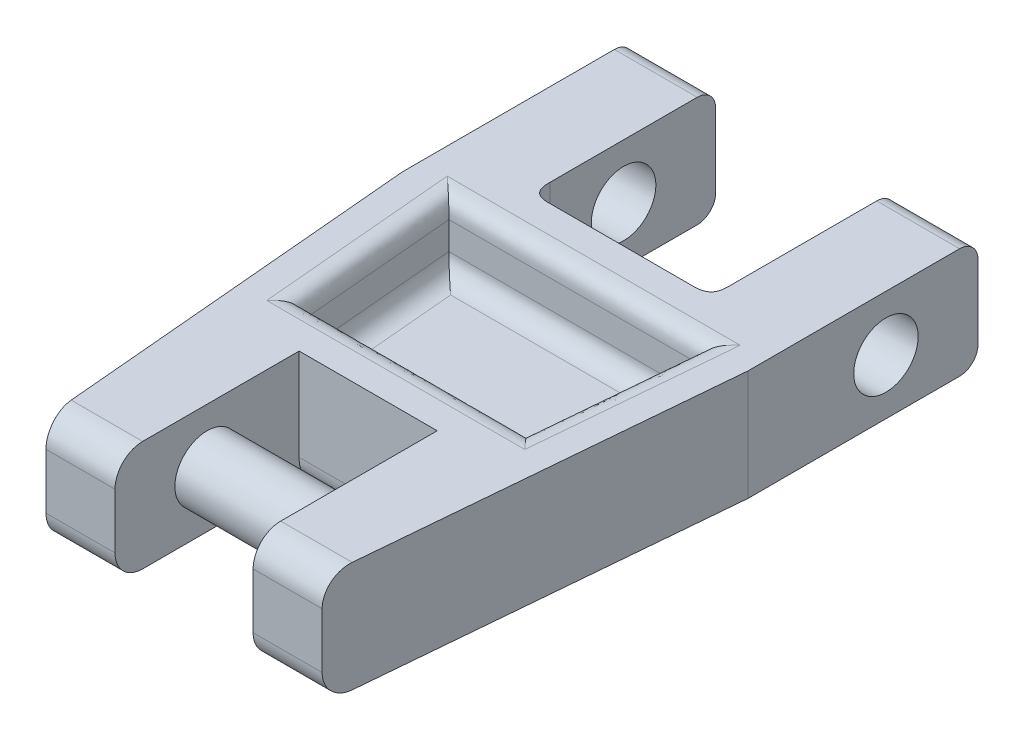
SolidWorks part; units mm, degrees
ref_plane "Front Plane" through (0, 0, 0) normal (0, 0, 1) x (1, 0, 0)
ref_plane "Top Plane" through (0, 0, 0) normal (0, 1, 0) x (1, 0, 0)
ref_plane "Right Plane" through (0, 0, 0) normal (1, 0, 0) x (0, 0, -1)
sketch "Sketch1" plane through (0, 0, 0) normal (0, 1, 0) x (1, 0, 0)
  line L0 (-165.918, 0) -> (-75.918, 0)
  line L1 (-165.918, 0) -> (-165.918, -250)
  line L2 (209.082, 0) -> (209.082, -250)
  line L3 (-165.918, -250) -> (-128.418, -675)
  line L4 (209.082, -250) -> (171.582, -675)
  line L5 (-128.418, -675) -> (-53.418, -675)
  line L6 (-53.418, -675) -> (-53.418, -475)
  line L7 (-53.418, -475) -> (96.582, -475)
  line L8 (96.582, -475) -> (96.582, -675)
  line L9 (96.582, -675) -> (171.582, -675)
  line L10 (-75.918, 0) -> (-75.918, -200)
  line L11 (-75.918, -200) -> (119.082, -200)
  line L12 (119.082, -200) -> (119.082, 0)
  line L13 (119.082, 0) -> (209.082, 0)
  point P4 (0, 0)
  point P14 (-116.3314, -151.9531)
  point P17 (114.082, -205.0143)
  point P18 (-75.918, -100)
  point P19 (-53.418, -575)
  point P20 (0, 0)
  dimension "D1" = 375
  dimension "D2" = 195
  dimension "D3" = 250
  dimension "D4" = 475
  dimension "D5" = 150
  dimension "D6" = 300
  dimension "D7" = 200
  dimension "D8" = 100
extrude "Boss-Extrude1" add sketch "Sketch1" along normal blind 120
sketch "Sketch2" plane through (119.082, 0, 0) normal (-1, 0, 0) x (0, 0, 1)
  line L0 (100, 120) -> (100, 0) construction
  line L1 (0, 120) -> (200, 120) construction
  line L2 (0, 0) -> (200, 0) construction
  line L3 (0, 60) -> (200, 60) construction
  line L4 (0, 120) -> (0, 0) construction
  line L5 (200, 120) -> (200, 0) construction
  circle A0 centre (100, 60) radius 35
  point P14 (0, 0)
  point P15 (100, 60)
  dimension "D1" = 70
extrude "Cut-Extrude1" cut sketch "Sketch2" against normal through all both and the other way through all
fillet "Fillet1" radius 20 2 edges at (164.082, 0, 0) (164.082, 120, 0)
fillet "Fillet2" radius 20 2 edges at (-120.918, 0, 0) (-120.918, 120, 0)
shell "Shell1" thickness 50
fillet "Fillet3" radius 20 4 edges at (21.582, 50, 250) (151.1672, 50, 337.5) (21.582, 50, 425) (-108.0031, 50, 337.5)
fillet "Fillet4" [suppressed] radius 10
sketch "Sketch3" plane through (96.582, 0, 0) normal (-1, 0, 0) x (0, 0, 1)
  line L0 (575, 120) -> (575, 0) construction
  line L1 (475, 120) -> (675, 120) construction
  line L2 (475, 0) -> (675, 0) construction
  line L3 (475, 60) -> (675, 60) construction
  line L4 (475, 120) -> (475, 0) construction
  line L5 (675, 120) -> (675, 0) construction
  circle A0 centre (575, 60) radius 35
  dimension "D1" = 70
fillet "Fillet5" radius 30 2 edges at (-90.918, 0, 675) (-90.918, 120, 675)
fillet "Fillet6" radius 30 2 edges at (134.082, 0, 675) (134.082, 120, 675)
fillet "Fillet10" radius 20 1 edges at (21.582, 0, 475)
fillet "Fillet11" radius 50 1 edges at (21.582, 0, 200)
fillet "Fillet12" radius 20 4 edges
fillet "Fillet13" radius 20 4 edges at (21.582, 120, 250) (151.1672, 120, 337.5) (-108.0031, 120, 337.5) (21.582, 120, 425)
extrude "Boss-Extrude2" add sketch "Sketch3" along normal up to next
